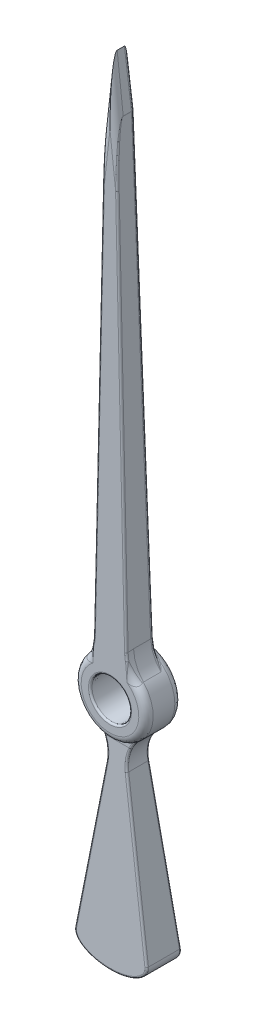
SolidWorks part; units mm, degrees
ref_plane "Спереди" through (0, 0, 0) normal (0, 0, 1) x (1, 0, 0)
ref_plane "Сверху" through (0, 0, 0) normal (0, 1, 0) x (1, 0, 0)
ref_plane "Справа" through (0, 0, 0) normal (1, 0, 0) x (0, 0, -1)
sketch "Эскиз1" plane through (0, 0, 0) normal (0, 0, 1) x (1, 0, 0)
  line L0 (0, 155) -> (0, -65) construction
  line L1 (2.8571, -17.0832) -> (9.9652, -59.5833)
  line L2 (-2.8571, -17.0832) -> (-9.9652, -59.5833)
  line L3 (-1.673, 140) -> (-4.5435, 13.5049)
  line L4 (0, 0) -> (-4.85, 0) construction
  line L5 (-1.673, 140) -> (0, 155)
  line L6 (1.673, 140) -> (0, 155)
  line L7 (1.673, 140) -> (4.5435, 13.5049)
  line L8 (-20.628, -10) -> (29.259, -10) construction
  line L9 (-6.3601, -7.7168) -> (6.3601, -7.7168) construction
  circle A0 centre (0, 0) radius 5.5
  arc A1 (6.3601, -7.7168) -> (7.2705, 6.8659) centre (0, 0) ccw
  circle A2 centre (0, 0) radius 65 construction
  arc A4 (-2.8571, -17.0832) -> (-6.3601, -7.7168) centre (-12.7202, -15.4337) ccw
  arc A5 (2.8571, -17.0832) -> (6.3601, -7.7168) centre (12.7202, -15.4337) cw
  arc A6 (-7.2705, 6.8659) -> (-6.3601, -7.7168) centre (0, 0) ccw
  arc A7 (-4.5435, 13.5049) -> (-7.2705, 6.8659) centre (-14.541, 13.7317) cw
  arc A8 (4.5435, 13.5049) -> (7.2705, 6.8659) centre (14.541, 13.7317) ccw
  ellipse E0 centre (0, -60) end of major axis (10, -60) minor radius 5 (-9.9652, -59.5833) -> (9.9652, -59.5833) ccw
  point P21 (-4.6491, 8.8536)
  dimension "D1" = 11
  dimension "D2" = 20
  dimension "D3" = 130
  dimension "D5" = 20
  dimension "D6" = 10
  dimension "D9" = 10
  dimension "D7" = 1.3
  dimension "D8" = 4.85
  dimension "D10" = 140
  dimension "D11" = 155
  dimension "D12" = 10
sketch "Эскиз5" plane through (0, 0, 0) normal (0, 0, 1) x (1, 0, 0)
  circle A2 centre (0, 0) radius 10
  arc A3 (-7.2705, 6.8659) -> (-6.3601, -7.7168) centre (0, 0) ccw construction
extrude "Бобышка-Вытянуть2" add sketch "Эскиз5" along normal mid plane 10
fillet "Скругление6" radius 2 2 edges at (10, 0, -5) (10, 0, 5)
sketch "Эскиз12" plane through (0, 0, 0) normal (0, 0, 1) x (1, 0, 0)
  line L0 (-1.673, 140) -> (0, 155) construction
  line L1 (1.673, 140) -> (0, 155) construction
  line L2 (-1.673, 140) -> (-4.5435, 13.5049) construction
  line L3 (1.673, 140) -> (4.5435, 13.5049) construction
  line L4 (-1.673, 140) -> (0, 155)
  line L5 (1.673, 140) -> (0, 155)
  line L6 (-1.673, 140) -> (-4.85, 0)
  line L7 (1.673, 140) -> (4.85, 0)
  line L8 (0, 0) -> (-4.85, 0) construction
  line L9 (0, 0) -> (-4.85, 0)
  line L10 (0, 0) -> (4.85, 0)
extrude "Бобышка-Вытянуть6" add sketch "Эскиз12" along normal mid plane 10 separate body
sketch "Эскиз13" plane through (0, 0, 0) normal (1, 0, 0) x (0, 0, -1)
  line L0 (0, 155) -> (3, 0)
  line L1 (3, 10) -> (3, -10) construction
  line L2 (0, 155) -> (0, 0) construction
  line L3 (0, 0) -> (5, 0) construction
  line L4 (5, -8) -> (5, 8) construction
  line L5 (0, 10) -> (5, 10) construction
  line L6 (3, 0) -> (5, 0)
  line L7 (5, 0) -> (5, 140) construction
  line L8 (-5, 155) -> (5, 155) construction
  line L9 (0, 155) -> (5, 155)
  line L10 (5, 155) -> (5, 0)
  dimension "D3" = 10
extrude "Вырез-Вытянуть1" cut sketch "Эскиз13" against normal mid plane 20
combine bodies "Соединить1" operation type add bodies to combine 136 106
fillet "Скругление7" radius 10 4 edges at (-4.6581, 8.4547, 4.1258) (4.6615, 8.3052, 4.2952) (-4.6491, 8.8536, 0.0857) (4.6491, 8.8536, 0.0857)
fillet "Скругление8" radius 2 2 edges at (-0.8365, 147.5, 5) (0.8365, 147.5, 5)
fillet "Скругление9" radius 0.5 4 edges at (4.6262, 9.8623, 5) (1.673, 140, 1.3548) (1.8235, 133.3652, 4.4142) (3.3681, 65.3002, 5)
fillet "Скругление11" radius 0.5 2 edges at (-1.673, 140, 1.3548) (-1.8235, 133.3652, 4.4142)
fillet "Скругление16" radius 1 8 edges at (-0.8353, 147.511, -0.1449) (-1.6725, 140, -0.2903) (-5.2909, 9.9323, -2.8078) (0.8353, 147.511, -0.1449) (1.6725, 140, -0.2903) (3.1085, 76.7414, -1.5147) (-3.1085, 76.7414, -1.5147) (5.2909, 9.9323, -2.8078)
fillet "Скругление17" radius 1 3 edges at (-5.7969, 8.1484, -2.6291) (5.7969, 8.1484, -2.6291) (0, 10, -2.8065)
sketch "Эскиз14" plane through (0, 0, 0) normal (1, 0, 0) x (0, 0, -1)
  line L0 (0, 0) -> (0, -65) construction
  line L1 (0, 155) -> (0, -65) construction
  line L2 (0, 65) -> (0, -65) construction
  line L3 (0, 0) -> (-2.4829, 0) construction
  line L4 (-2.9096, -11.0177) -> (-5, -65)
  line L5 (-5, -65) -> (5, -65)
  line L6 (-5, 6.4715) -> (-5, -8) construction
  line L7 (0, 0) -> (-5, 0) construction
  line L8 (3, -7.7168) -> (-3, -7.7168)
  line L9 (-3, 6.8659) -> (-3, -10) construction
  line L10 (2.9096, -11.0177) -> (5, -65)
  arc A0 (-2.9096, -11.0177) -> (-3, -7.7168) centre (-27.8909, -10.0503) ccw
  arc A1 (2.9096, -11.0177) -> (3, -7.7168) centre (27.8909, -10.0503) cw
  point P27 (0, -7.7168)
  dimension "D1" = 50
extrude "Бобышка-Вытянуть7" add sketch "Эскиз14" along normal mid plane 20 separate body
sketch "Эскиз15" plane through (0, 0, 0) normal (0, 0, 1) x (1, 0, 0)
  line L0 (-2.8571, -17.0832) -> (-9.9652, -59.5833) construction
  line L1 (2.8571, -17.0832) -> (9.9652, -59.5833) construction
  line L2 (-6.3601, -7.7168) -> (6.3601, -7.7168) construction
  line L3 (-2.8571, -17.0832) -> (-9.9652, -59.5833)
  line L4 (2.8571, -17.0832) -> (9.9652, -59.5833)
  line L5 (-6.3601, -7.7168) -> (6.3601, -7.7168)
  arc A0 (-2.8571, -17.0832) -> (-6.3601, -7.7168) centre (-12.7202, -15.4337) ccw construction
  arc A1 (6.3601, -7.7168) -> (2.8571, -17.0832) centre (12.7202, -15.4337) ccw construction
  arc A2 (-2.8571, -17.0832) -> (-6.3601, -7.7168) centre (-12.7202, -15.4337) ccw
  arc A3 (6.3601, -7.7168) -> (2.8571, -17.0832) centre (12.7202, -15.4337) ccw
  ellipse E0 centre (0, -60) end of major axis (10, -60) minor radius 5 (-9.9652, -59.5833) -> (9.9652, -59.5833) ccw construction
  ellipse E1 centre (0, -60) end of major axis (10, -60) minor radius 5 (-9.9652, -59.5833) -> (9.9652, -59.5833) ccw
extrude "Вырез-Вытянуть2" cut sketch "Эскиз15" against normal mid plane 10 flip side to cut
fillet "Скругление19" radius 0.5 14 edges at (-4.2069, -10.1873, -2.8912) (-2.8263, -13.9805, -3.0243) (-6.4112, -38.3333, -3.9674) (1.0131, -64.9743, -4.999) (5.6582, -8.3535, -2.9485) (2.8263, -13.9805, -3.0243) (4.2069, -10.1873, 2.8912) (2.8263, -13.9805, 3.0243) (-5.6582, -8.3535, 2.9485) (-2.8263, -13.9805, 3.0243) (-6.4112, -38.3333, 3.9674) (2.0798, -64.8907, 4.9958) (6.4112, -38.3333, -3.9674) (6.4112, -38.3333, 3.9674)
sketch "Эскиз16" plane through (0, 0, 0) normal (0, 0, 1) x (1, 0, 0)
  circle A0 centre (0, 0) radius 5.5 construction
  circle A1 centre (0, 0) radius 5.5
extrude "Вырез-Вытянуть3" cut sketch "Эскиз16" against normal mid plane 10
fillet "Скругление20" radius 0.5 2 edges at (5.5, 0, -5) (5.5, 0, 5)
